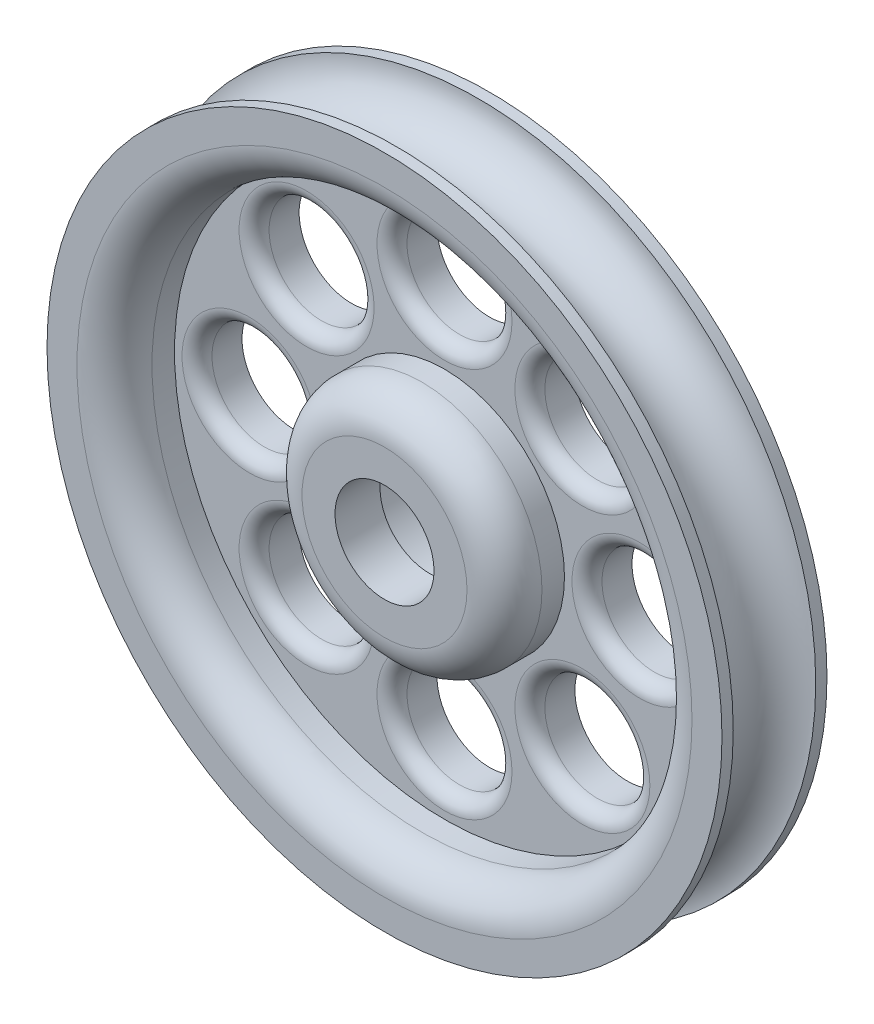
SolidWorks part; units mm, degrees
ref_plane "Plan de face" through (0, 0, 0) normal (0, 0, 1) x (1, 0, 0)
ref_plane "Plan de dessus" through (0, 0, 0) normal (0, 1, 0) x (1, 0, 0)
ref_plane "Plan de droite" through (0, 0, 0) normal (1, 0, 0) x (0, 0, -1)
sketch "Esquisse1" plane through (0, 0, 0) normal (0, 0, 1) x (1, 0, 0)
  line L0 (21.8997, 0) -> (-10.2306, 0) construction
  line L1 (0, -3.5796) -> (0, 17.5359) construction
  circle A0 centre (0, 0) radius 22.5
extrude "Boss.-Extru.1" add sketch "Esquisse1" along normal blind 7
ref_plane "Plan1" through (0, 0, 0) normal (1, 0, 0) x (0, 0, -1)
sketch "Esquisse4" plane through (0, 0, 0) normal (1, 0, 0) x (0, 0, -1)
  line L0 (-12.1122, 22.5) -> (1.8949, 22.5) construction
  line L1 (-3.5, 22.5) -> (-3.5, 17.3814) construction
  line L2 (0, 22.5) -> (-7, 22.5) construction
  line L3 (5.4985, 0) -> (-20.0841, 0) construction
  circle A0 centre (-3.5, 22.5) radius 2.75
revolve "Enlèvement de matière-Révolution1" cut sketch "Esquisse4" angle 360 about L3
sketch "Esquisse6" plane through (0, 0, 7) normal (0, 0, 1) x (1, 0, 0)
  circle A0 centre (0, 0) radius 8
  circle A1 centre (0, 0) radius 18
extrude "Enlèv. mat.-Extru.2" cut sketch "Esquisse6" against normal blind 4
sketch "Esquisse7" plane through (0, 0, 3) normal (0, 0, 1) x (1, 0, 0)
  line L0 (0, 24.5372) -> (0, -1.077) construction
  circle A0 centre (0, 0) radius 13 construction
  circle A1 centre (0, 13) radius 3.5
  circle A2 centre (9.1924, 9.1924) radius 3.5
  circle A3 centre (13, 0) radius 3.5
  circle A4 centre (9.1924, -9.1924) radius 3.5
  circle A5 centre (0, -13) radius 3.5
  circle A6 centre (-9.1924, -9.1924) radius 3.5
  circle A7 centre (-13, 0) radius 3.5
  circle A8 centre (-9.1924, 9.1924) radius 3.5
  point P23 (0, 0)
  dimension "D1" = 8
extrude "Enlèv. mat.-Extru.3" cut sketch "Esquisse7" against normal through all
fillet "Congé2" radius 2.5 2 edges at (8, 0, 7) (18, 0, 7)
fillet "Congé3" radius 1 8 edges at (3.5, 13, 3) (-5.6924, 9.1924, 3) (-5.6924, -9.1924, 3) (-9.5, 0, 3) (3.5, -13, 3) (12.6924, -9.1924, 3) (16.5, 0, 3) (12.6924, 9.1924, 3)
sketch "Esquisse9" plane through (0, 0, 0) normal (0, 0, -1) x (-1, 0, 0)
  circle A0 centre (0, 0) radius 4.95
extrude "Enlèv. mat.-Extru.5" cut sketch "Esquisse9" against normal blind 4
sketch "Esquisse10" plane through (0, 0, 4) normal (0, 0, -1) x (-1, 0, 0)
  circle A0 centre (0, 0) radius 3.3
extrude "Enlèv. mat.-Extru.6" cut sketch "Esquisse10" against normal blind 3
